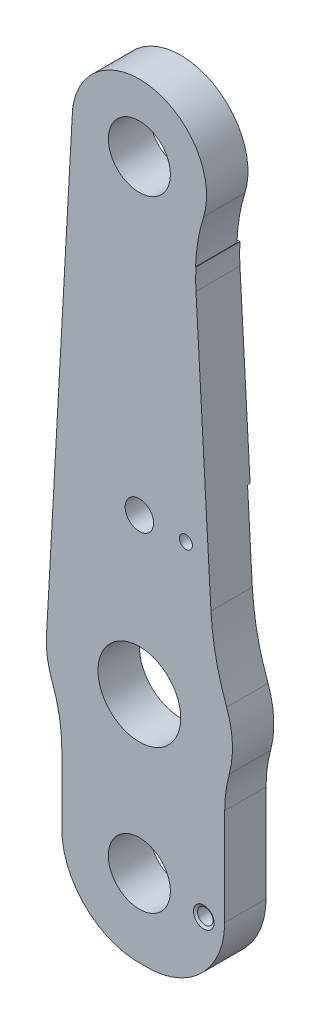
SolidWorks part; units mm, degrees
ref_plane "Plan1" through (0, 0, 0) normal (0, 0, 1) x (1, 0, 0)
ref_plane "Plan2" through (0, 0, 0) normal (0, 1, 0) x (1, 0, 0)
ref_plane "Plan3" through (0, 0, 0) normal (1, 0, 0) x (0, 0, -1)
sketch "Esquisse1" plane through (0, 0, 0) normal (0, 0, 1) x (1, 0, 0)
  line L0 (-110, 0) -> (110, 0) construction
  line L1 (0, 100) -> (0, -240) construction
  line L2 (21.7961, -32.3302) -> (27.6833, -138.3002)
  line L4 (-80, -240) -> (110, -240) construction
  line L5 (3, -190) -> (3, -250) construction
  line L6 (-50, -180) -> (50, -180) construction
  line L7 (-30, -240) -> (-30, -213.4066)
  line L8 (33, -240) -> (33, -202.5167)
  line L9 (-70, -120) -> (60, -120) construction
  line L12 (-26, 0) -> (-35.7785, -176.0123)
  arc A0 (24.8323, -7.7045) -> (-26, 0) centre (0, 0) ccw
  circle A1 centre (0, -120) radius 5.5
  circle A2 centre (0, 0) radius 12
  circle A3 centre (0, -240) radius 12
  arc A4 (1.5, -269.9625) -> (33, -240) centre (3, -240) ccw
  arc A6 (34.7442, -189.4256) -> (33.7578, -167.4935) centre (0, -180) ccw
  arc A7 (-33.75, -192.5275) -> (-30, -213.4066) centre (-90, -213.4066) cw
  arc A8 (33, -202.5167) -> (34.7442, -189.4256) centre (83, -202.5167) cw
  arc A10 (-35.7785, -176.0123) -> (-33.75, -192.5275) centre (0, -180) ccw
  arc A11 (27.6833, -138.3002) -> (33.7578, -167.4935) centre (127.5294, -132.7532) ccw
  arc A12 (21.7961, -32.3302) -> (24.8323, -7.7045) centre (91.6883, -28.4473) cw
  arc A14 (-30, -240) -> (1.5, -269.9625) centre (0, -240) ccw
  dimension "D1" = 52
  dimension "D2" = 120
  dimension "D3" = 24
  dimension "D6" = 11
  dimension "D7" = 60
  dimension "D8" = 60
  dimension "D9" = 24
  dimension "D10" = 72
  dimension "D11" = 60
  dimension "D12" = 50
  dimension "D14" = 100
  dimension "D15" = 70
  dimension "D4" = 240
  dimension "D5" = 3
extrude "Base-Extrusion" add sketch "Esquisse1" along normal blind 16
sketch "Esquisse2" plane through (0, 0, 16) normal (0, 0, 1) x (1, 0, 0)
  line L0 (-27.4444, -26) -> (21.9181, -26)
  line L1 (-60, 0) -> (90, 0) construction
  line L2 (-27.4444, -26) -> (-31.8333, -105)
  line L3 (21.8965, -34.1367) -> (25.8333, -105)
  line L4 (-26, 0) -> (-35.7785, -176.0123) construction
  line L5 (27.6833, -138.3002) -> (21.7961, -32.3302) construction
  line L6 (-60, -120) -> (70, -120) construction
  line L8 (-31.8333, -105) -> (25.8333, -105)
  arc A3 (21.8965, -34.1367) -> (21.9181, -26) centre (91.7887, -30.2538) cw
  dimension "D3" = 15
  dimension "D2" = 26
  dimension "D5" = 70
  dimension "D1" = 26
extrude "Boss.-Extru.1" add sketch "Esquisse2" against normal blind 17
sketch "Esquisse5" plane through (0, 0, 16) normal (0, 0, 1) x (1, 0, 0)
  line L0 (-40, -240) -> (40, -240) construction
  line L1 (0, -240) -> (44.5512, -243.8977) construction
  circle A1 centre (24.9049, -242.1789) radius 3
  dimension "D3" = 6
  dimension "D1" = 5
extrude "Enlèv. mat.-Extru.3" cut sketch "Esquisse5" against normal blind 10
ref_plane "Plan4" through (25, 0, 0) normal (1, 0, 0) x (0, 0, -1)
sketch "Esquisse6" plane through (25, 0, 0) normal (1, 0, 0) x (0, 0, -1)
  line L0 (2.7711, -242.1789) -> (-26.9073, -242.1789) construction
  line L1 (-6, -242.1789) -> (-16, -242.1789) construction
  line L2 (-6, -239.1789) -> (-3.4827, -242.1789)
  line L3 (-6, -239.1789) -> (-6, -245.1789) construction
  line L5 (-3.4827, -242.1789) -> (-6, -242.1789)
  line L6 (-6, -239.1789) -> (-6, -242.1789)
revolve "Enlèvement de matière-Révolution1" cut sketch "Esquisse6" angle 360 about L0
chamfer "Chanfrein2" distance 1 angle 30 1 edges at (27.9049, -242.1789, 16)
sketch "Esquisse7" plane through (0, 0, 16) normal (0, 0, 1) x (1, 0, 0)
  line L0 (0, -260) -> (0, -160) construction
  line L1 (-50, -180) -> (40, -180) construction
  line L2 (0, -153.0237) -> (0, -204.4941) construction
  circle A0 centre (0, -180) radius 16
  circle A2 centre (0, -240) radius 12 construction
  dimension "D2" = 32
  dimension "D1" = 60
extrude "Enlèv. mat.-Extru.4" cut sketch "Esquisse7" against normal through all
sketch "Esquisse8" plane through (0, 0, 16) normal (0, 0, 1) x (1, 0, 0)
  line L0 (-20, -120) -> (50, -120) construction
  line L1 (18, -110) -> (18, -200) construction
  circle A0 centre (18, -120) radius 2.5
  dimension "D2" = 5
  dimension "D1" = 18
extrude "Enlèv. mat.-Extru.5" cut sketch "Esquisse8" against normal through all
